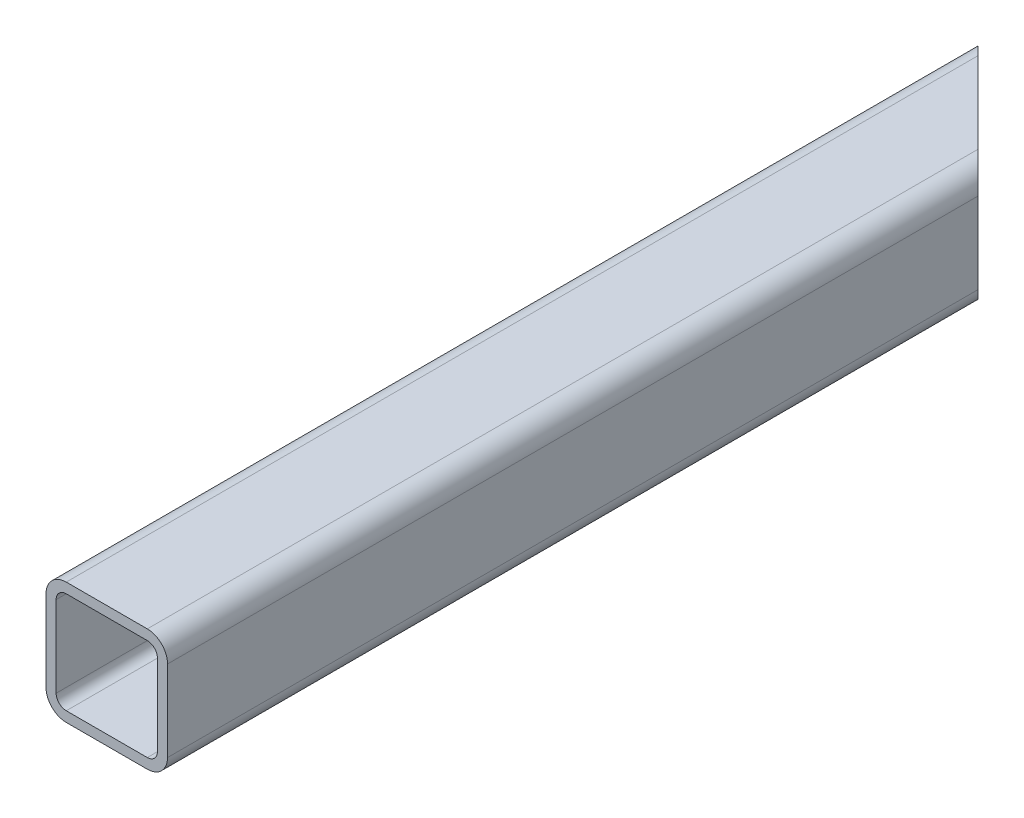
SolidWorks part; units mm, degrees
ref_plane "Plane1" through (0, 0, 0) normal (0, 0, 1) x (1, 0, 0)
ref_plane "Plane2" through (0, 0, 0) normal (0, 1, 0) x (1, 0, 0)
ref_plane "Plane3" through (0, 0, 0) normal (1, 0, 0) x (0, 0, -1)
sketch "Sketch1" plane through (0, 0, 0) normal (0, 0, 1) x (1, 0, 0)
  line L0 (-20, -25) -> (20, -25)
  line L1 (-25, -20) -> (-25, 20)
  line L2 (20, 25) -> (-20, 25)
  line L3 (25, 20) -> (25, -20)
  line L4 (-20, -30) -> (20, -30)
  line L5 (-30, -20) -> (-30, 20)
  line L6 (20, 30) -> (-20, 30)
  line L7 (30, 20) -> (30, -20)
  line L8 (-30, 0) -> (-25, 0) construction
  line L9 (-25, 0) -> (25, 0) construction
  line L10 (25, 0) -> (30, 0) construction
  line L12 (0, 30) -> (0, 25) construction
  line L13 (0, 25) -> (0, -25) construction
  line L14 (0, -25) -> (0, -30) construction
  arc A0 (30, 20) -> (20, 30) centre (20, 20) ccw
  arc A1 (20, -30) -> (30, -20) centre (20, -20) ccw
  arc A2 (-30, -20) -> (-20, -30) centre (-20, -20) ccw
  arc A3 (-20, 30) -> (-30, 20) centre (-20, 20) ccw
  arc A4 (-20, 25) -> (-25, 20) centre (-20, 20) ccw
  arc A5 (25, 20) -> (20, 25) centre (20, 20) ccw
  arc A6 (20, -25) -> (25, -20) centre (20, -20) ccw
  arc A7 (-25, -20) -> (-20, -25) centre (-20, -20) ccw
  point P2 (-30, 30)
  point P33 (-30, -30)
  point P34 (30, -30)
  point P36 (30, 30)
extrude "Extrusion1" add sketch "Sketch1" along normal blind 460
sketch "Esquisse2" plane through (0, 30, 0) normal (0, 1, 0) x (1, 0, 0)
  line L0 (30, -60) -> (-30, 0)
  line L1 (-30, 0) -> (30, 0)
  line L2 (30, 0) -> (30, -60)
  line L3 (20, 0) -> (-20, 0) construction
  line L4 (-30, -460) -> (-30, 0) construction
  dimension "D1" = 60
  dimension "D2" = 60
  dimension "D3" = 0
  dimension "D4" = 0
extrude "Extrusion3" cut sketch "Esquisse2" against normal through all
